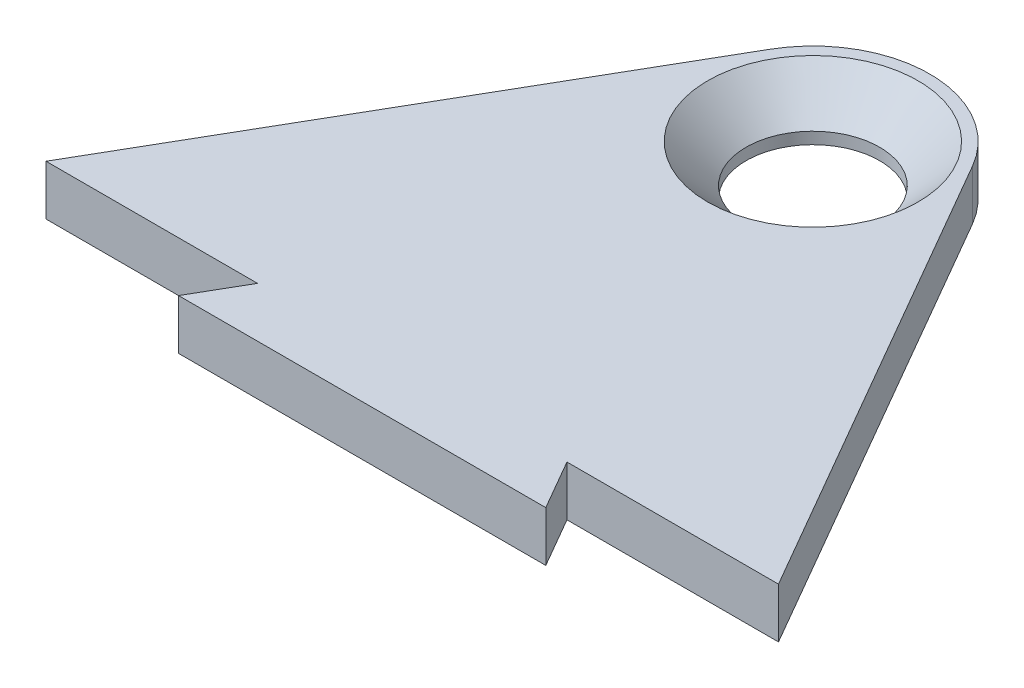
SolidWorks part; units mm, degrees
ref_plane "Front" through (0, 0, 0) normal (0, 0, 1) x (1, 0, 0)
ref_plane "Top" through (0, 0, 0) normal (0, 1, 0) x (1, 0, 0)
ref_plane "Right" through (0, 0, 0) normal (1, 0, 0) x (0, 0, -1)
sketch "Sketch1" plane through (0, 0, 0) normal (0, 1, 0) x (1, 0, 0)
  line L0 (0, 0) -> (0, 27) construction
  line L3 (9.2679, 3) -> (21.9393, 3)
  line L4 (-11, 0) -> (-9.2679, 3)
  line L5 (-21.9393, 3) -> (-9.2679, 3)
  line L6 (11, 0) -> (9.2679, 3)
  line L7 (-11, 0) -> (11, 0)
  line L8 (21.9393, 3) -> (6.0622, 30.5)
  line L9 (-21.9393, 3) -> (-6.0622, 30.5)
  arc A1 (6.0622, 30.5) -> (-6.0622, 30.5) centre (0, 27) ccw
  dimension "D1" = 22
  dimension "D3" = 60
  dimension "D5" = 7
  dimension "D2" = 60
  dimension "D4" = 3
  dimension "D6" = 24
  dimension "D7" = 60
  dimension "D8" = 60
extrude "Extrude1" add sketch "Sketch1" along normal blind 3
sketch "Sketch2" plane through (0, 3, 0) normal (0, 1, 0) x (1, 0, 0)
  line L0 (-11, 0) -> (11, 0) construction
  point P0 (0, 27)
  dimension "D1" = 27
  dimension "D2" = 11
hole_wizard "CSK for M6 Countersunk Flat Head Screw1" positions "3DSketch1" profile "Sketch4" countersink size "M6" standard "ISO"
sketch3d "3DSketch1"
  point P0 (0, 3, -27)
sketch "Sketch4" plane through (0, 3, -27) normal (1, 0, 0) x (0, 0, 1)
  line L0 (0, 0) -> (0, 3)
  line L1 (0, 3) -> (4, 3)
  line L2 (4, 3) -> (4, 2.3)
  line L3 (4, 2.3) -> (6.3, 0)
  line L5 (6.3, 0) -> (0, 0)
  line L6 (-4, 2.3) -> (-6.3, 0) construction
  line L11 (0, -6.35) -> (0, 107.95) construction
  dimension "Thru Hole Dia." = 8
  dimension "Thru Hole Depth" = 3
  dimension "Near C'Sink Dia." = 12.6
  dimension "Near C'Sink Angle" = 90
